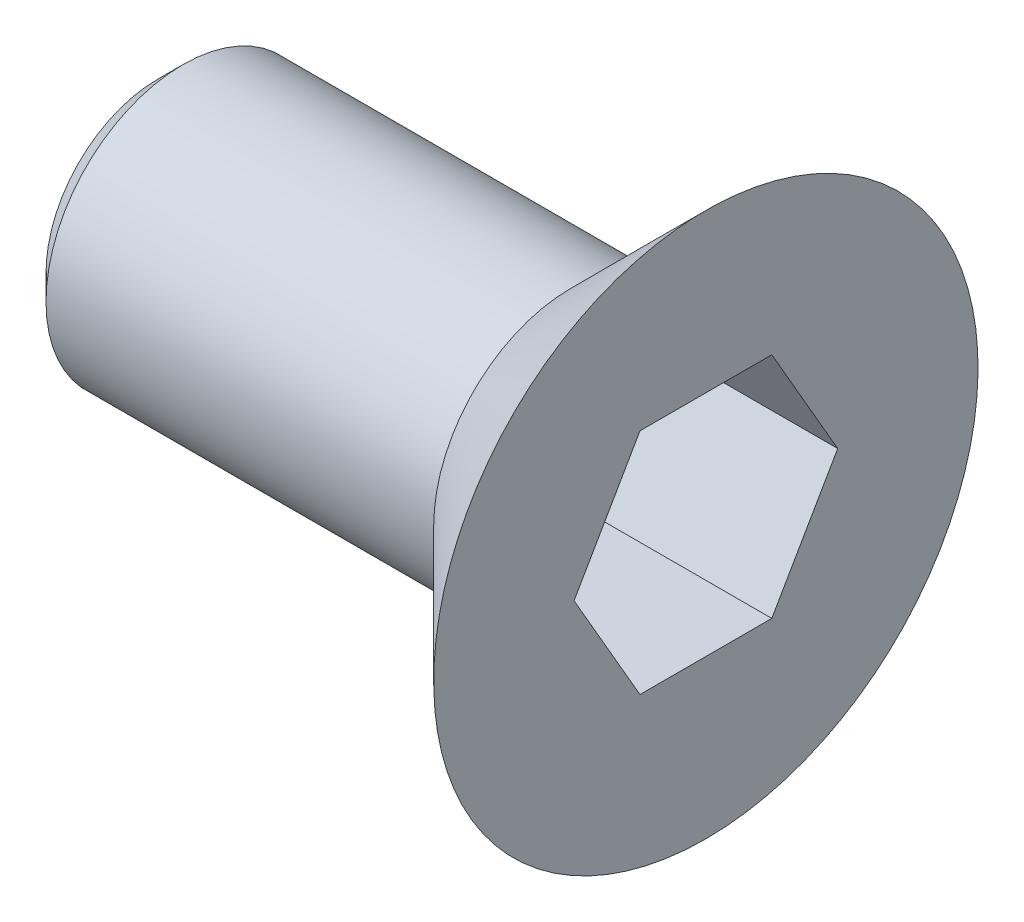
SolidWorks part; units mm, degrees
ref_plane "Face" through (0, 0, 0) normal (0, 0, 1) x (1, 0, 0)
ref_plane "Dessus" through (0, 0, 0) normal (0, 1, 0) x (1, 0, 0)
ref_plane "Droite" through (0, 0, 0) normal (1, 0, 0) x (0, 0, -1)
sketch "Esquisse1" plane through (0, 0, 0) normal (0, 0, 1) x (1, 0, 0)
  line L0 (2.0473, 0) -> (2.0473, 3)
  line L1 (2.0473, 3) -> (11.0873, 3)
  line L2 (11.0873, 3) -> (14.0473, 5.96)
  line L3 (14.0473, 5.96) -> (14.0473, 0)
  line L4 (-40.583, 0) -> (14.0473, 0) construction
  line L5 (2.0473, 0) -> (14.0473, 0)
  dimension "D1" = 12
  dimension "D2" = 135
  dimension "D3" = 3
  dimension "D4" = 5.96
revolve "Base-Révolution" add sketch "Esquisse1" angle 360 about L4
sketch "Esquisse2" plane through (14.0473, 0, 0) normal (1, 0, 0) x (0, 0, -1)
  line L1 (2.8868, 0) -> (1.4434, 2.5)
  line L2 (1.4434, 2.5) -> (-1.4434, 2.5)
  line L3 (-1.4434, 2.5) -> (-2.8868, 0)
  line L4 (-2.8868, 0) -> (-1.4434, -2.5)
  line L5 (-1.4434, -2.5) -> (1.4434, -2.5)
  line L6 (1.4434, -2.5) -> (2.8868, 0)
  circle A0 centre (0, 0) radius 2.5 construction
  dimension "D1" = 5
extrude "Enlèv. mat.-Extru.1" cut sketch "Esquisse2" against normal blind 4
chamfer "Chanfrein1" distance 0.55 angle 45 1 edges at (2.0473, -3, 0)
